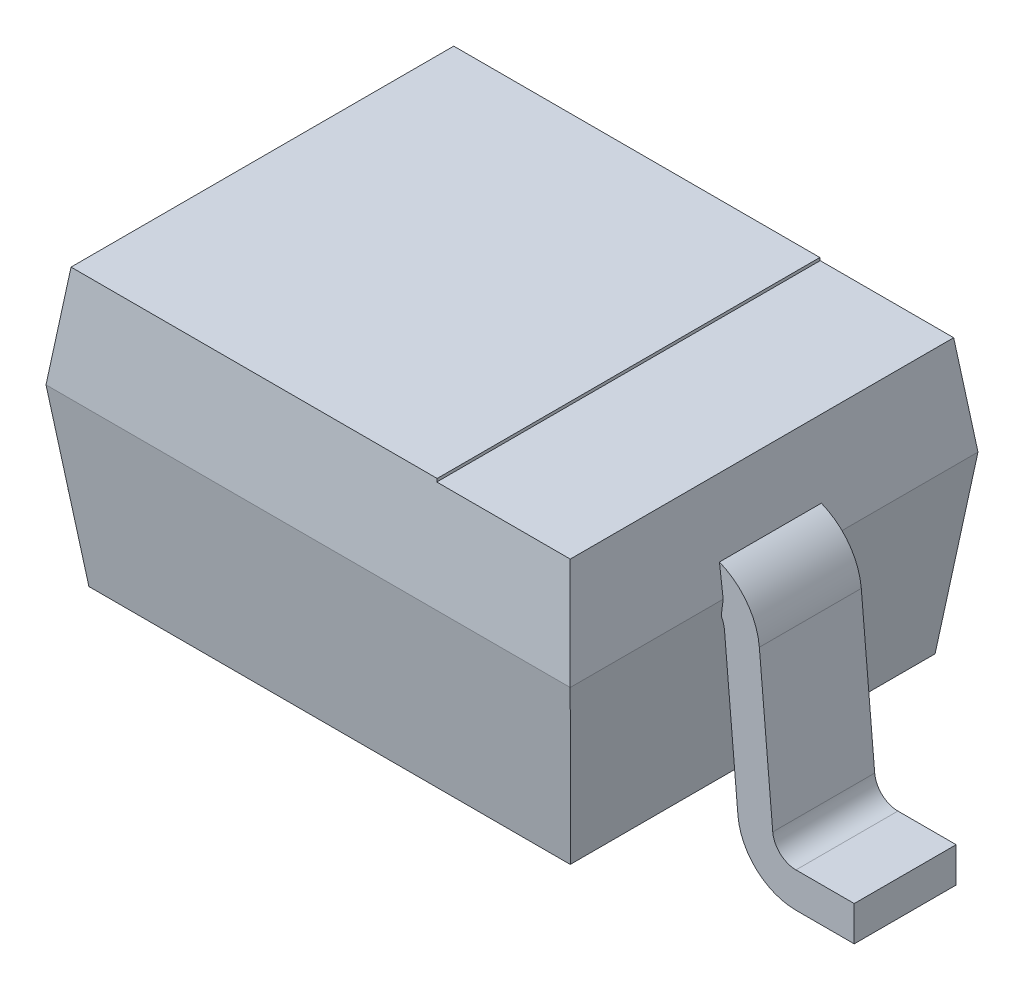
SolidWorks part; units mm, degrees
ref_plane "Front" through (0, 0, 0) normal (0, 0, 1) x (1, 0, 0)
ref_plane "Top" through (0, 0, 0) normal (0, 1, 0) x (1, 0, 0)
ref_plane "Right" through (0, 0, 0) normal (1, 0, 0) x (0, 0, -1)
sketch "Эскиз1" plane through (0, 0, 0) normal (0, 1, 0) x (1, 0, 0)
  line L1 (-0.9, -0.7) -> (0.9, -0.7)
  line L2 (-0.9, -0.7) -> (-0.9, 0.7)
  line L3 (-0.9, 0.7) -> (0.9, 0.7)
  line L4 (0.9, -0.7) -> (0.9, 0.7)
  line L5 (-0.9, -0.7) -> (0.9, 0.7) construction
  line L6 (-0.9, 0.7) -> (0.9, -0.7) construction
  point P0 (0, 0)
  dimension "D1" = 1.8
  dimension "D2" = 1.4
extrude "Вытянуть1" add sketch "Эскиз1" along normal blind 0.35 draft 7 and the other way blind 0.6 draft 7 from offset 0.8
sketch "Эскиз2" plane through (0, 0, 0) normal (0, 0, 1) x (1, 0, 0)
  line L0 (-1.35, 0) -> (-1.15, 0)
  line L1 (-0.9508, 0.1826) -> (-0.9047, 0.7087)
  line L2 (-0.8051, 0.8) -> (0, 0.8)
  line L3 (-1.35, 0.12) -> (-1.15, 0.12)
  line L4 (-1.0703, 0.193) -> (-1.0243, 0.7192)
  line L5 (-0.8051, 0.92) -> (0, 0.92)
  line L6 (-1.35, 0) -> (-1.35, 0.12)
  line L7 (0, 0) -> (0, 0.8) construction
  line L8 (1.35, 0) -> (1.35, 0.12)
  line L9 (0.8051, 0.92) -> (0, 0.92)
  line L10 (1.0703, 0.193) -> (1.0243, 0.7192)
  line L11 (1.35, 0.12) -> (1.15, 0.12)
  line L12 (0.8051, 0.8) -> (0, 0.8)
  line L13 (0.9508, 0.1826) -> (0.9047, 0.7087)
  line L14 (1.35, 0) -> (1.15, 0)
  arc A0 (-0.9047, 0.7087) -> (-0.8051, 0.8) centre (-0.8051, 0.7) cw
  arc A1 (-1.15, 0) -> (-0.9508, 0.1826) centre (-1.15, 0.2) ccw
  arc A2 (-1.15, 0.12) -> (-1.0703, 0.193) centre (-1.15, 0.2) ccw
  arc A3 (-1.0243, 0.7192) -> (-0.8051, 0.92) centre (-0.8051, 0.7) cw
  arc A4 (1.0243, 0.7192) -> (0.8051, 0.92) centre (0.8051, 0.7) ccw
  arc A5 (1.15, 0.12) -> (1.0703, 0.193) centre (1.15, 0.2) cw
  arc A6 (1.15, 0) -> (0.9508, 0.1826) centre (1.15, 0.2) cw
  arc A7 (0.9047, 0.7087) -> (0.8051, 0.8) centre (0.8051, 0.7) ccw
  dimension "D1" = 0.1
  dimension "D2" = 0.2
  dimension "D4" = 2.7
  dimension "D5" = 85
  dimension "D6" = 0.2
  dimension "D7" = 0.8
  dimension "D3" = 0.12
extrude "Вытянуть2" add sketch "Эскиз2" along normal mid plane 0.35
sketch "Эскиз3" plane through (0, 1.15, 0) normal (0, 1, 0) x (1, 0, 0)
  line L1 (-0.9, -0.7) -> (0.9, -0.7) construction
  line L2 (0.9, 0.7) -> (0.4, 0.7)
  line L3 (0.9, 0.7) -> (0.9, -0.7)
  line L4 (0.9, -0.7) -> (0.4, -0.7)
  line L5 (0.4, 0.7) -> (0.4, -0.7)
  dimension "D1" = 0.5
extrude "Вытянуть3" cut sketch "Эскиз3" against normal blind 0.01
